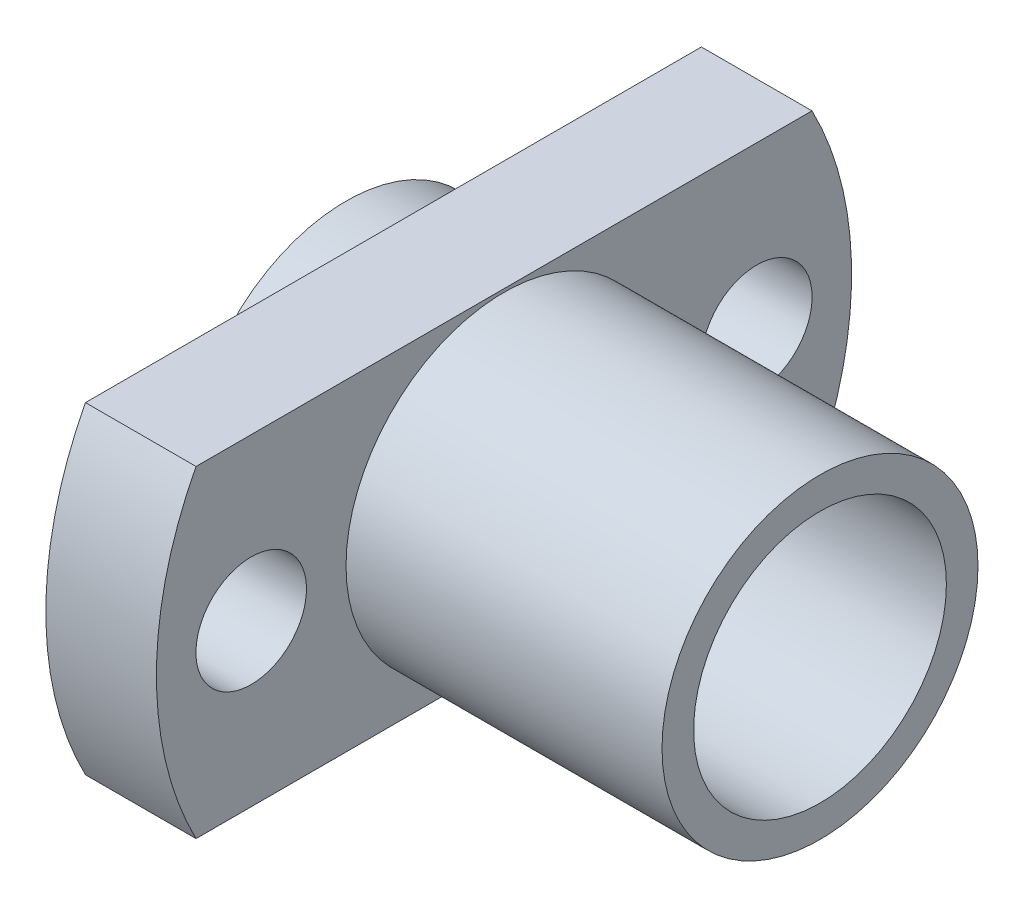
SolidWorks part; units mm, degrees
ref_plane "前视基准面" through (0, 0, 0) normal (0, 0, 1) x (1, 0, 0)
ref_plane "上视基准面" through (0, 0, 0) normal (0, 1, 0) x (1, 0, 0)
ref_plane "右视基准面" through (0, 0, 0) normal (1, 0, 0) x (0, 0, -1)
sketch "草图1" plane through (0, 0, 0) normal (1, 0, 0) x (0, 0, -1)
  circle A0 centre (0, 0) radius 5
  circle A1 centre (0, 0) radius 4
extrude "凸台-拉伸1" add sketch "草图1" along normal blind 1.5
sketch "草图2" plane through (1.5, 0, 0) normal (1, 0, 0) x (0, 0, -1)
  line L0 (0, 0) -> (27.5866, 0) construction
  line L1 (0, 0) -> (0, 8.7846) construction
  line L2 (-9.7463, 5.1) -> (9.7463, 5.1)
  line L3 (-9.7463, -5.1) -> (9.7463, -5.1)
  circle A0 centre (0, 0) radius 4
  arc A1 (9.7463, -5.1) -> (9.7463, 5.1) centre (0, 0) ccw
  circle A2 centre (0, 0) radius 8 construction
  circle A3 centre (-8, 0) radius 1.75
  circle A4 centre (8, 0) radius 1.75
  arc A5 (-9.7463, 5.1) -> (-9.7463, -5.1) centre (0, 0) ccw
  point P16 (0, 0)
  dimension "D1" = 3.5
  dimension "D3" = 5.1
  dimension "D4" = 5.1
  dimension "D2" = 2
extrude "凸台-拉伸2" add sketch "草图2" along normal blind 3.5
sketch "草图3" plane through (5, 0, 0) normal (1, 0, 0) x (0, 0, -1)
  circle A0 centre (0, 0) radius 4
  circle A1 centre (0, 0) radius 5
extrude "凸台-拉伸3" add sketch "草图3" along normal blind 10
